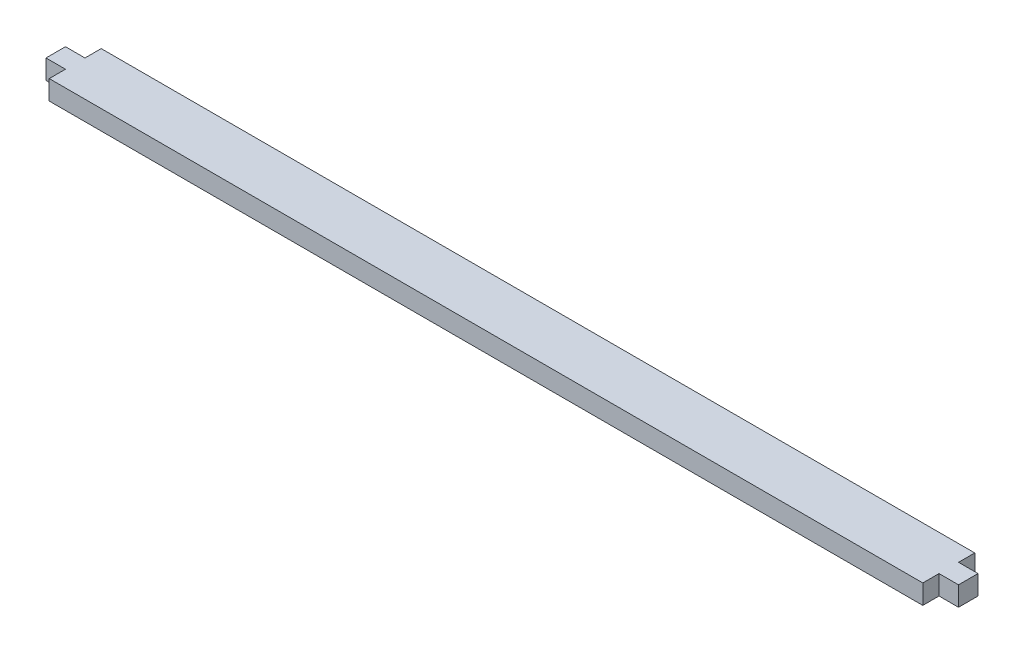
SolidWorks part; units mm, degrees
ref_plane "Front Plane" through (0, 0, 0) normal (0, 0, 1) x (1, 0, 0)
ref_plane "Top Plane" through (0, 0, 0) normal (0, 1, 0) x (1, 0, 0)
ref_plane "Right Plane" through (0, 0, 0) normal (1, 0, 0) x (0, 0, -1)
sketch "Sketch1" plane through (0, 0, 0) normal (0, 1, 0) x (1, 0, 0)
  line L1 (-70.25, 4) -> (70.25, 4)
  line L2 (-70.25, 4) -> (-70.25, -4)
  line L3 (-70.25, -4) -> (70.25, -4)
  line L4 (70.25, 4) -> (70.25, -4)
  line L5 (-70.25, 4) -> (70.25, -4) construction
  line L6 (-70.25, -4) -> (70.25, 4) construction
  point P0 (0, 0)
  dimension "D1" = 8
  dimension "D2" = 140.5
extrude "Boss-Extrude1" add sketch "Sketch1" along normal blind 3
sketch "Sketch2" plane through (0, 0, 0) normal (0, 1, 0) x (1, 0, 0)
  line L0 (0, 0) -> (0, 7.1148) construction
  line L1 (-70.25, 4) -> (-67.25, 4)
  line L2 (-70.25, 4) -> (-70.25, 1.5)
  line L3 (-70.25, 1.5) -> (-67.25, 1.5)
  line L5 (-67.25, 4) -> (-67.25, 1.5)
  line L6 (-70.25, -4) -> (-67.25, -4)
  line L7 (-70.25, -4) -> (-70.25, -1.5)
  line L8 (-70.25, -1.5) -> (-67.25, -1.5)
  line L9 (-67.25, -4) -> (-67.25, -1.5)
  line L11 (67.25, -4) -> (67.25, -1.5)
  line L12 (70.25, -1.5) -> (67.25, -1.5)
  line L13 (70.25, -4) -> (70.25, -1.5)
  line L14 (70.25, -4) -> (67.25, -4)
  line L15 (67.25, 4) -> (67.25, 1.5)
  line L16 (70.25, 1.5) -> (67.25, 1.5)
  line L17 (70.25, 4) -> (70.25, 1.5)
  line L18 (70.25, 4) -> (67.25, 4)
  dimension "D1" = 2.5
  dimension "D2" = 3
extrude "Cut-Extrude1" cut sketch "Sketch2" along normal blind 3
